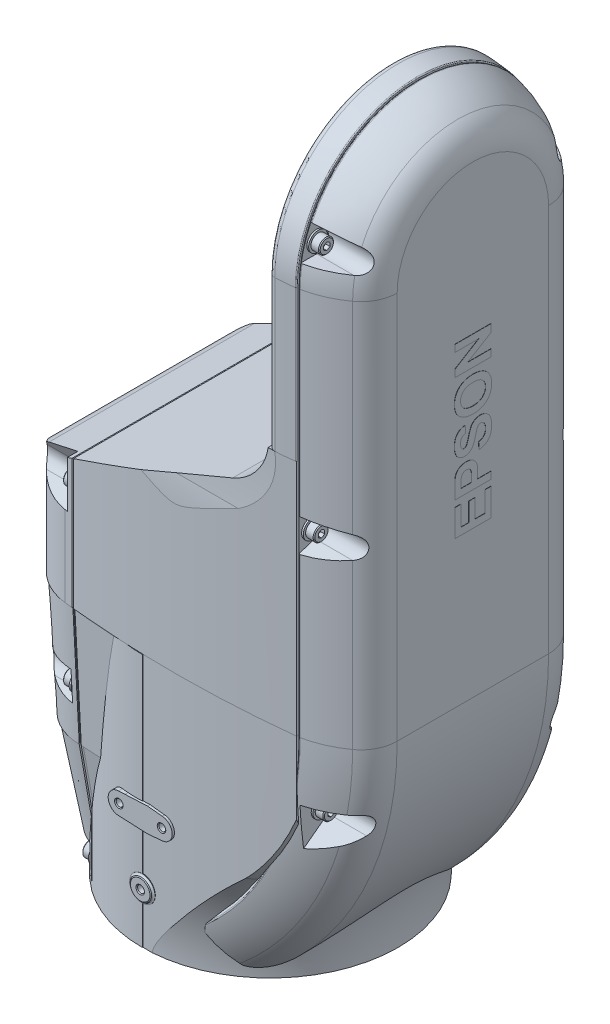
SolidWorks part; units mm, degrees
ref_plane "Front Plane" through (0, 0, 0) normal (0, 0, 1) x (1, 0, 0)
ref_plane "Top Plane" through (0, 0, 0) normal (0, 1, 0) x (1, 0, 0)
ref_plane "Right Plane" through (0, 0, 0) normal (1, 0, 0) x (0, 0, -1)
imported_body "Imported1"
sketch "Sketch1" plane through (95, 0, 0) normal (1, 0, 0) x (0, 0, -1)
  line L0 (0, 119) -> (0, 336.5029) construction
  line L1 (35.5029, 119) -> (-35.5029, 119) construction
  line L2 (8.5, 119) -> (8.5, 335.4704) construction
  arc A0 (35.5029, 301) -> (-35.5029, 301) centre (0, 301) ccw construction
  text T0 "EPSON" font "Arial" height 17
  dimension "D1" = 8.5
extrude "Boss-Extrude1" add sketch "Sketch1" along normal blind 0.1
